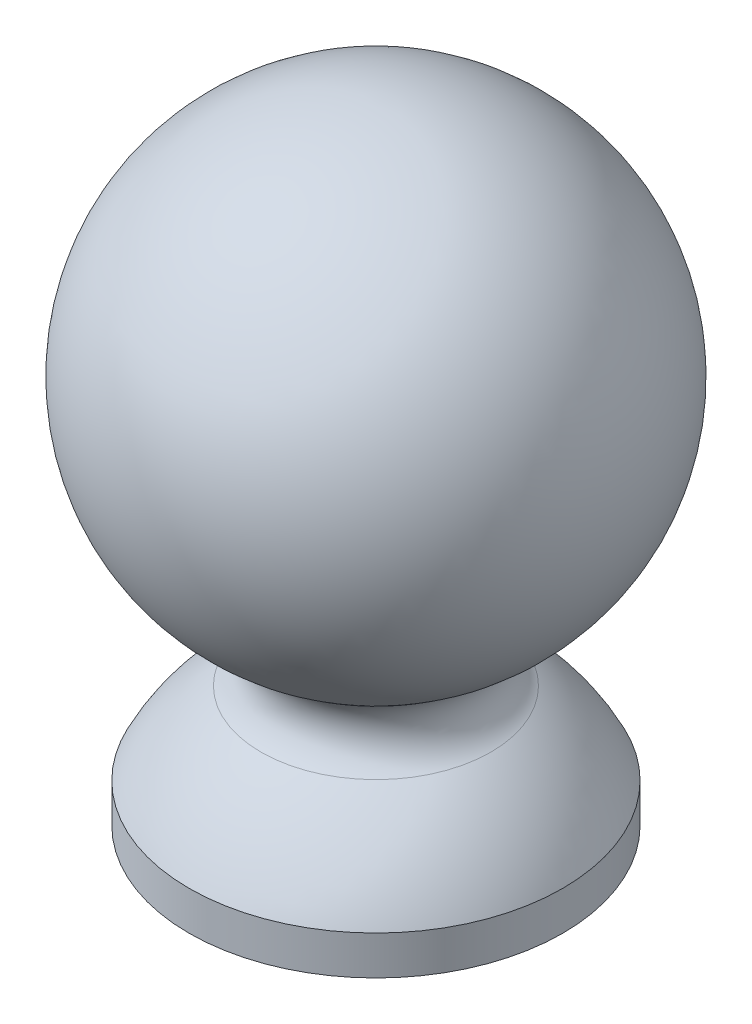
SolidWorks part; units mm, degrees
ref_plane "Front Plane" through (0, 0, 0) normal (0, 0, 1) x (1, 0, 0)
ref_plane "Top Plane" through (0, 0, 0) normal (0, 1, 0) x (1, 0, 0)
ref_plane "Right Plane" through (0, 0, 0) normal (1, 0, 0) x (0, 0, -1)
sketch "Sketch1" plane through (0, 0, 0) normal (0, 0, 1) x (1, 0, 0)
  line L0 (0, 30) -> (0, -30)
  line L1 (0, -45) -> (-24, -45)
  line L2 (0, -45) -> (0, -30)
  arc A0 (0, 30) -> (-15.0295, -25.9637) centre (0, 0) ccw
  arc A1 (-24, -45) -> (-14.7687, -34.4565) centre (0, -56.7) cw
  arc A2 (-15.0295, -25.9637) -> (-14.7687, -34.4565) centre (-17.5344, -30.291) cw
  dimension "D1" = 30
  dimension "D3" = 5
  dimension "D2" = 24
revolve "Revolve1" add sketch "Sketch1" angle 360 about L0
sketch "Sketch4" plane through (0, -45, 0) normal (0, -1, 0) x (1, 0, 0)
  circle A0 centre (0, 0) radius 24
extrude "Boss-Extrude1" add sketch "Sketch4" along normal blind 5
sketch "Sketch5" plane through (0, -50, 0) normal (0, -1, 0) x (1, 0, 0)
  circle A0 centre (0, 0) radius 12
  dimension "D1" = 24
extrude "Cut-Extrude2" cut sketch "Sketch5" against normal blind 3.5
sketch "Sketch6" plane through (0, -50, 0) normal (0, -1, 0) x (1, 0, 0)
  circle A0 centre (-19, 0) radius 2.75
  circle A1 centre (0, 19) radius 2.75
  circle A2 centre (19, 0) radius 2.75
  circle A3 centre (0, -19) radius 2.75
  point P12 (0, 0)
  dimension "D1" = 5.5
  dimension "D2" = 19
  dimension "D3" = 4
extrude "Cut-Extrude3" cut sketch "Sketch6" against normal blind 5.5
